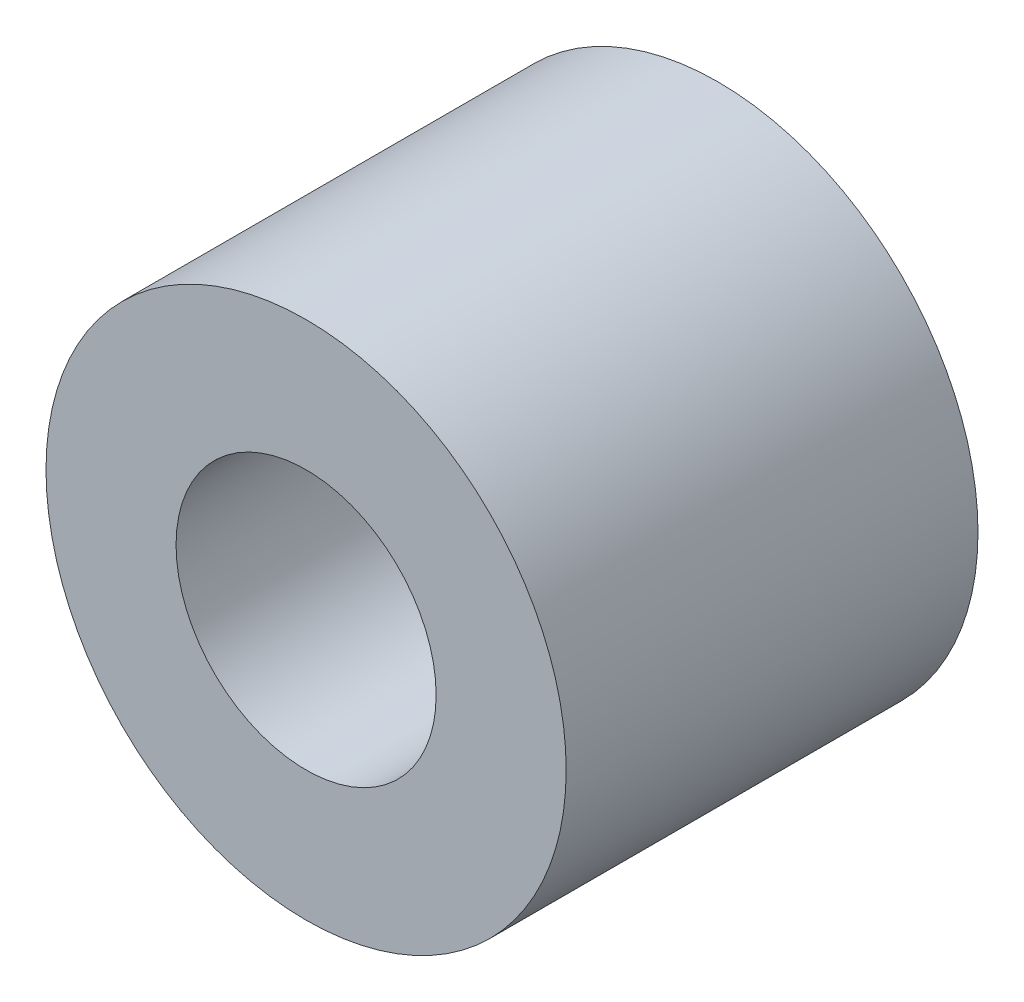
SolidWorks part; units mm, degrees
ref_plane "Front Plane" through (0, 0, 0) normal (0, 0, 1) x (1, 0, 0)
ref_plane "Top Plane" through (0, 0, 0) normal (0, 1, 0) x (1, 0, 0)
ref_plane "Right Plane" through (0, 0, 0) normal (1, 0, 0) x (0, 0, -1)
sketch "Sketch1" plane through (0, 0, 0) normal (0, 0, 1) x (1, 0, 0)
  circle A0 centre (0, 0) radius 6
  circle A1 centre (0, 0) radius 3
  dimension "D1" = 12
  dimension "D2" = 6
extrude "Boss-Extrude1" add sketch "Sketch1" along normal blind 9.5
